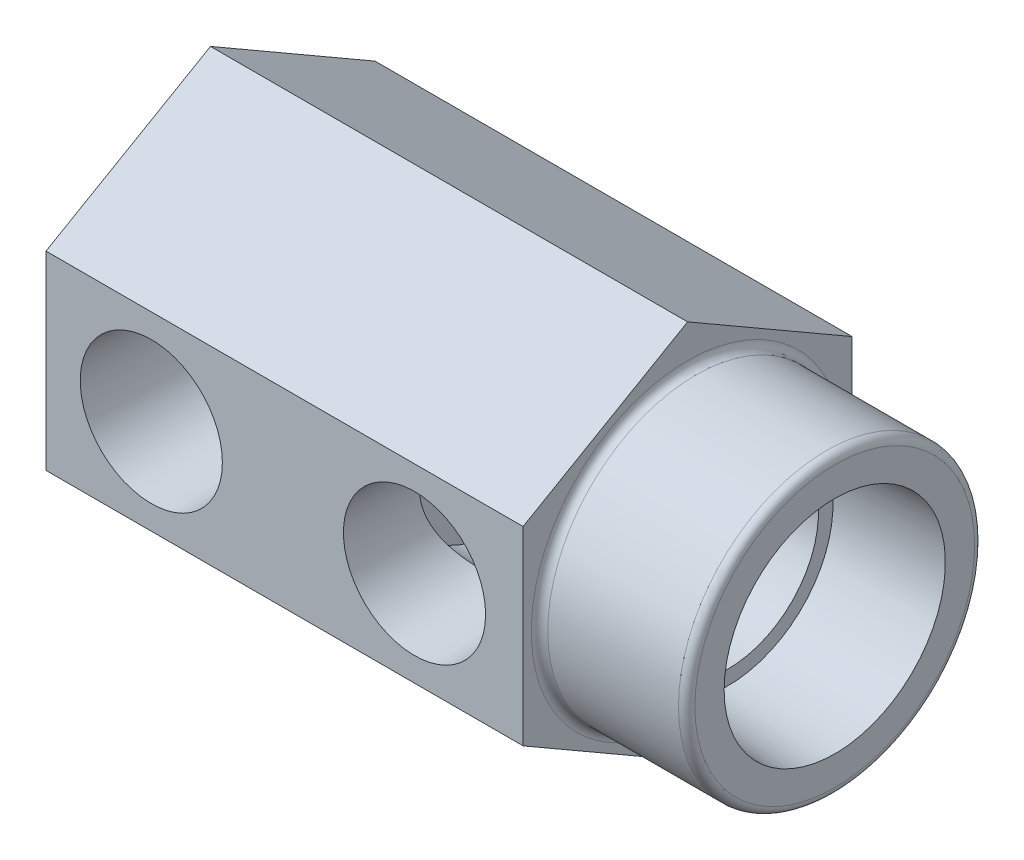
SolidWorks part; units mm, degrees
ref_plane "Front Plane" through (0, 0, 0) normal (0, 0, 1) x (1, 0, 0)
ref_plane "Top Plane" through (0, 0, 0) normal (0, 1, 0) x (1, 0, 0)
ref_plane "Right Plane" through (0, 0, 0) normal (1, 0, 0) x (0, 0, -1)
sketch "Sketch2" plane through (0, 0, 0) normal (1, 0, 0) x (0, 0, -1)
  line L1 (15.875, -9.1654) -> (15.875, 9.1654)
  line L2 (15.875, 9.1654) -> (0, 18.3309)
  line L3 (0, 18.3309) -> (-15.875, 9.1654)
  line L4 (-15.875, 9.1654) -> (-15.875, -9.1654)
  line L5 (-15.875, -9.1654) -> (0, -18.3309)
  line L6 (0, -18.3309) -> (15.875, -9.1654)
  line L7 (0, 20.164) -> (0, -20.164) construction
  circle A0 centre (0, 0) radius 15.875 construction
  dimension "D1" = 31.75
extrude "Boss-Extrude1" add sketch "Sketch2" along normal blind 46.0375 separate body
sketch "Sketch3" plane through (46.0375, 0, 0) normal (1, 0, 0) x (0, 0, -1)
  circle A1 centre (0, 0) radius 14.2875
  dimension "D1" = 28.575
extrude "Boss-Extrude2" add sketch "Sketch3" along normal blind 14.1986
sketch "Sketch5" plane through (0, 0, 0) normal (0, 1, 0) x (1, 0, 0)
  line L0 (-14.0019, 0) -> (49985.9981, 0) construction
  line L12 (49.9364, 8.7312) -> (27.2161, 8.7312)
  line L13 (49.9364, 8.7312) -> (49.9364, 10.1346)
  line L14 (60.2361, 10.6744) -> (49.9364, 10.1346)
  line L15 (60.2361, -14.2875) -> (60.2361, 14.2875) construction
  line L16 (60.2361, 0) -> (60.2361, 10.6744)
  line L18 (27.2161, 0) -> (27.2161, 8.7312)
  line L19 (27.2161, 0) -> (60.2361, 0)
  dimension "D1" = 10.2997
  dimension "D2" = 33.02
  dimension "D5" = 3
  dimension "D8" = 17.4625
  dimension "D11" = 20.2692
revolve "Cut-Revolve1" cut sketch "Sketch5" angle 360 about L0
hole_wizard "1/4 NPT Tapped Hole1" positions "Sketch7" profile "Sketch6" size "1/4" standard "Ansi Inch"
sketch "Sketch7" plane through (0, 0, -15.875) normal (0, 0, -1) x (-1, 0, 0)
  line L0 (17.4625, 0) -> (-17.4625, 0) construction
  line L1 (0, 17.4625) -> (0, -17.4625) construction
  point P0 (-10.16, 0)
  dimension "D1" = 10.16
sketch "Sketch6" plane through (10.16, 0, -15.875) normal (1, 0, 0) x (0, 1, 0)
  line L0 (0, 0) -> (0, 20.4111)
  line L1 (5.5626, 17.0688) -> (0, 20.4111)
  line L2 (-5.5626, 17.0688) -> (0, 20.4111) construction
  line L3 (5.5626, 17.0688) -> (5.5626, 10.0203)
  line L4 (5.5626, 10.0203) -> (6.558, 10.0203)
  line L5 (6.558, 10.0203) -> (6.858, 0)
  line L6 (-6.558, 10.0203) -> (-6.858, 0) construction
  line L7 (6.858, 0) -> (0, 0)
  line L8 (0, -6.35) -> (0, 107.95) construction
  line L11 (-5.5626, 10.0203) -> (-6.558, 10.0203) construction
  dimension "Tap Drill Dia." = 11.1252
  dimension "Tap Drill Depth" = 17.0688
  dimension "Thread Dia." = 13.716
  dimension "Thread Angle" = 3.43
  dimension "Thread Depth" = 10.0203
  dimension "Drill Angle" = 118
hole_wizard "1/4 NPT Tapped Hole2" positions "Sketch9" profile "Sketch8" size "1/4" standard "Ansi Inch"
sketch "Sketch9" plane through (0, 0, 15.875) normal (0, 0, 1) x (1, 0, 0)
  line L0 (0, -17.4625) -> (0, 17.4625) construction
  circle A0 centre (10.16, 0) radius 6.858 construction
  point P0 (10.16, 0)
  point P5 (35.56, 0)
  dimension "D1" = 35.56
sketch "Sketch8" plane through (10.16, 0, 15.875) normal (1, 0, 0) x (0, -1, 0)
  line L0 (0, 0) -> (0, 16.0423)
  line L1 (5.5626, 12.7) -> (0, 16.0423)
  line L2 (-5.5626, 12.7) -> (0, 16.0423) construction
  line L3 (5.5626, 12.7) -> (5.5626, 10.0203)
  line L4 (5.5626, 10.0203) -> (6.558, 10.0203)
  line L5 (6.558, 10.0203) -> (6.858, 0)
  line L6 (-6.558, 10.0203) -> (-6.858, 0) construction
  line L7 (6.858, 0) -> (0, 0)
  line L8 (0, -6.35) -> (0, 107.95) construction
  line L11 (-5.5626, 10.0203) -> (-6.558, 10.0203) construction
  dimension "Tap Drill Dia." = 11.1252
  dimension "Tap Drill Depth" = 12.7
  dimension "Thread Dia." = 13.716
  dimension "Thread Angle" = 3.43
  dimension "Thread Depth" = 10.0203
  dimension "Drill Angle" = 118
fillet "Fillet1" radius 0.7937 2 edges at (60.2361, 0, -14.2875) (46.0375, 0, -14.2875)
hole_wizard "25/64 (0.39063) Diameter Hole1" positions "Sketch13" profile "Sketch12" hole size "25/64" standard "Ansi Inch"
sketch "Sketch13" plane through (60.2361, 0, 0) normal (1, 0, 0) x (0, 0, -1)
  circle A0 centre (0, 0) radius 10.6744 construction
  point P0 (0, 0)
sketch "Sketch12" plane through (60.2361, 0, 0) normal (0, 1, 0) x (0, 0, -1)
  line L0 (0, 0) -> (0, 53.7809)
  line L1 (0, 53.7809) -> (4.961, 50.8)
  line L2 (4.961, 50.8) -> (4.961, 0)
  line L5 (4.961, 0) -> (0, 0)
  line L10 (0, 53.7809) -> (-4.961, 50.8) construction
  line L11 (0, -6.35) -> (0, 107.95) construction
  dimension "Hole Dia." = 9.922
  dimension "Hole Depth" = 50.8
  dimension "Drill Angle" = 118
hole_wizard "7/16 (0.4375) Diameter Hole1" positions "Sketch11" profile "Sketch10" hole size "7/16" standard "Ansi Inch"
sketch "Sketch11" plane through (60.2361, 0, 0) normal (1, 0, 0) x (0, 0, -1)
  circle A0 centre (0, 0) radius 10.6744 construction
  point P0 (0, 0)
sketch "Sketch10" plane through (60.2361, 0, 0) normal (0, 1, 0) x (0, 0, -1)
  line L0 (0, 0) -> (0, 49.0585)
  line L1 (0, 49.0585) -> (5.5562, 45.72)
  line L2 (5.5562, 45.72) -> (5.5562, 0)
  line L5 (5.5562, 0) -> (0, 0)
  line L10 (0, 49.0585) -> (-5.5563, 45.72) construction
  line L11 (0, -6.35) -> (0, 107.95) construction
  dimension "Hole Dia." = 11.1125
  dimension "Hole Depth" = 45.72
  dimension "Drill Angle" = 118
